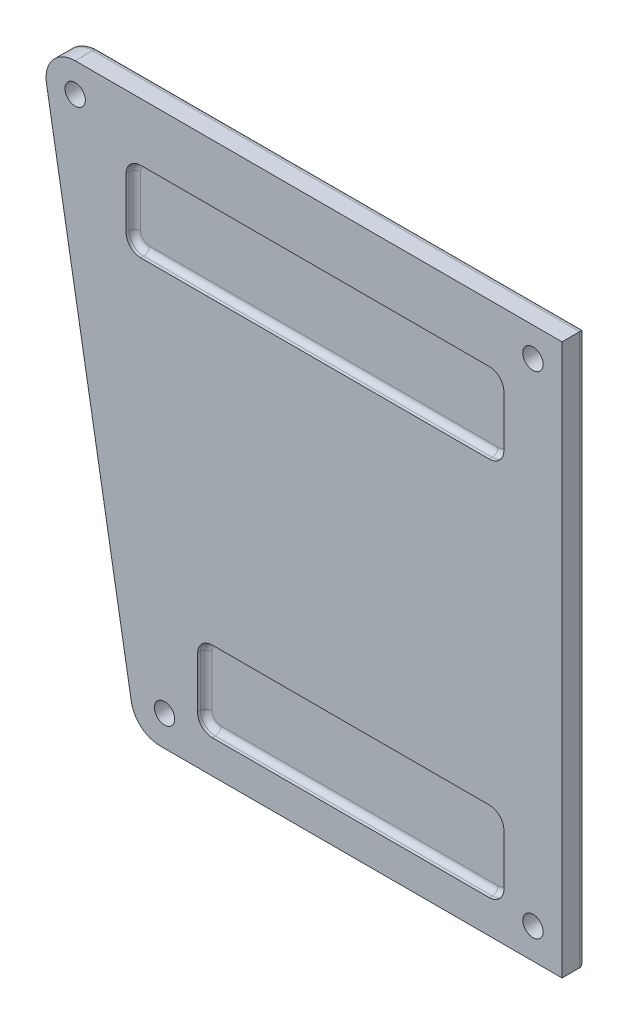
SolidWorks part; units mm, degrees
ref_plane "Plan de face" through (0, 0, 0) normal (0, 0, 1) x (1, 0, 0)
ref_plane "Plan de dessus" through (0, 0, 0) normal (0, 1, 0) x (1, 0, 0)
ref_plane "Plan de droite" through (0, 0, 0) normal (1, 0, 0) x (0, 0, -1)
mirrored part "Couvercle ( coté gauche ) OK_Rendre symétrique"
other "<Couvercle ( coté gauche ) OK>-<Enlèv. mat.-Extru.3>"
